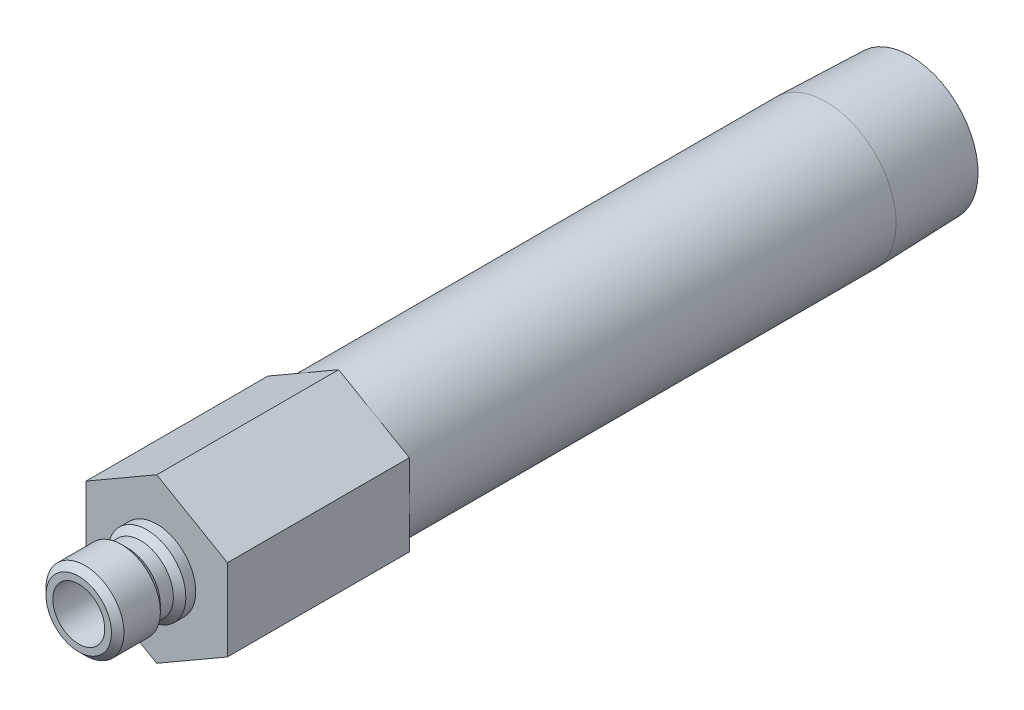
SolidWorks part; units mm, degrees
ref_plane "Front Plane" through (0, 0, 0) normal (0, 0, 1) x (1, 0, 0)
ref_plane "Top Plane" through (0, 0, 0) normal (0, 1, 0) x (1, 0, 0)
ref_plane "Right Plane" through (0, 0, 0) normal (1, 0, 0) x (0, 0, -1)
sketch "Sketch1" plane through (0, 0, 0) normal (1, 0, 0) x (0, 0, -1)
  line L0 (0, 0) -> (-12.7, 0) construction
  line L1 (-9.525, 3.175) -> (-9.525, 4.0005)
  line L2 (-3.556, 4.0005) -> (-3.556, 0) construction
  line L3 (-8.763, 4.7625) -> (-4.318, 4.7625)
  line L4 (0, 8.5725) -> (0, 0) construction
  line L5 (-3.556, 4.0005) -> (-1.9685, 4.0005)
  line L6 (-1.2065, 4.7625) -> (0, 4.7625)
  line L7 (0, 4.7625) -> (0, 8.5725)
  line L8 (-3.556, 4.0005) -> (-4.318, 4.7625)
  line L9 (-1.9685, 4.0005) -> (-1.2065, 4.7625)
  line L10 (-9.525, 4.0005) -> (-8.763, 4.7625)
  line L11 (-9.525, 3.175) -> (22.225, 3.175)
  line L12 (0, 8.5725) -> (81.7372, 8.5725)
  line L13 (81.7372, 8.5725) -> (92.075, 8.2494)
  line L14 (92.075, 8.2494) -> (92.075, 6.2611)
  line L15 (0, 0) -> (22.225, 0) construction
  line L16 (22.225, 0) -> (22.225, 3.175) construction
  line L17 (22.225, 4.7625) -> (0, 4.7625) construction
  line L18 (22.225, 3.175) -> (22.225, 6.2611)
  line L19 (22.225, 6.2611) -> (92.075, 6.2611)
  line L20 (22.225, 3.175) -> (22.225, 4.7625) construction
  dimension "D1" = 9.525
  dimension "D2" = 1.5875
  dimension "D3" = 0.762
  dimension "D4" = 45
  dimension "D5" = 5.969
  dimension "D6" = 45
  dimension "D7" = 1.79
  dimension "D8" = 10.3378
  dimension "D9" = 101.6
  dimension "D10" = 3.175
  dimension "D11" = 31.75
  dimension "D12" = 6.35
  dimension "D13" = 12.5222
  dimension "D14" = 9.525
  dimension "D15" = 17.145
revolve "Revolve1" add sketch "Sketch1" angle 360 about L0
sketch "Sketch2" plane through (0, 0, 0) normal (0, 0, 1) x (1, 0, 0)
  line L1 (-8.636, 4.986) -> (-8.636, -4.986)
  line L2 (-8.636, -4.986) -> (0, -9.972)
  line L3 (0, -9.972) -> (8.636, -4.986)
  line L4 (8.636, -4.986) -> (8.636, 4.986)
  line L5 (8.636, 4.986) -> (0, 9.972)
  line L6 (0, 9.972) -> (-8.636, 4.986)
  circle A0 centre (0, 0) radius 8.636 construction
  circle A1 centre (0, 0) radius 3.175 construction
  circle A2 centre (0, 0) radius 3.175
  dimension "D1" = 17.272
extrude "Boss-Extrude1" add sketch "Sketch2" against normal up to vertex (22.225 mm away) from vertex at 0
